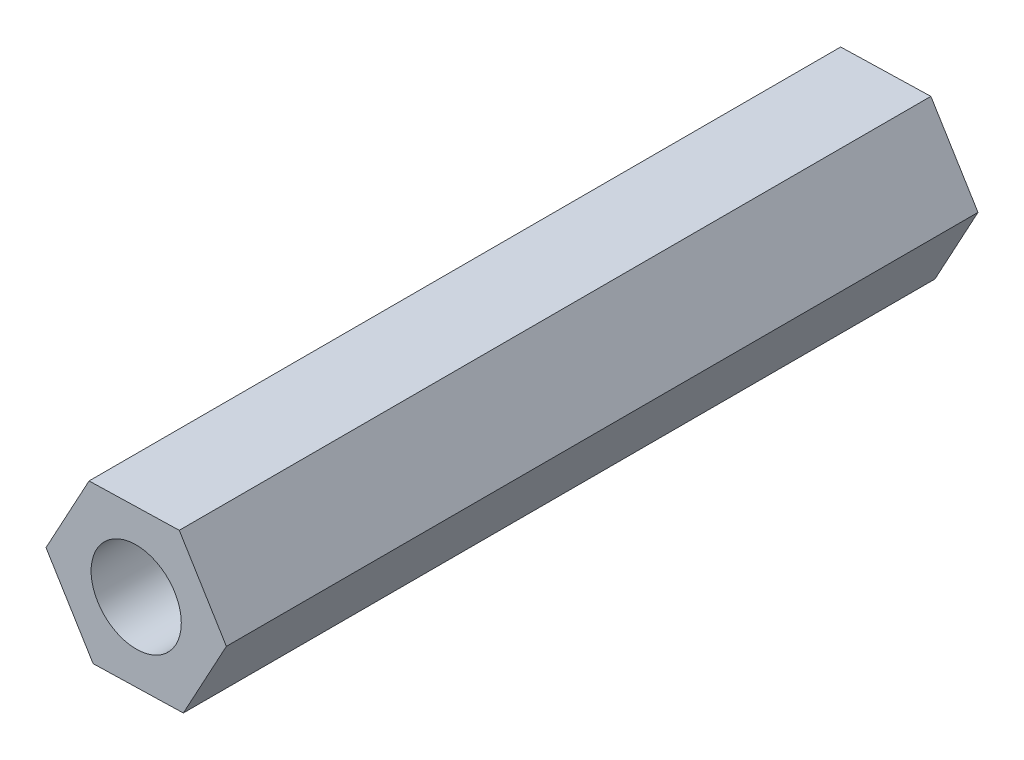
SolidWorks part; units mm, degrees
ref_plane "Plan de face" through (0, 0, 0) normal (0, 0, 1) x (1, 0, 0)
ref_plane "Plan de dessus" through (0, 0, 0) normal (0, 1, 0) x (1, 0, 0)
ref_plane "Plan de droite" through (0, 0, 0) normal (1, 0, 0) x (0, 0, -1)
ref_plane "Plan1" through (0, 0, 0) normal (0, 0, -1) x (-1, 0, 0)
sketch "Esquisse1" plane through (0, 0, 0) normal (0, 0, -1) x (-1, 0, 0)
  line L0 (1.4325, -2.6371) -> (3, -0.078)
  line L1 (3, -0.078) -> (1.5675, 2.5591)
  line L2 (1.5675, 2.5591) -> (-1.4325, 2.6371)
  line L3 (-1.4325, 2.6371) -> (-3, 0.078)
  line L4 (-3, 0.078) -> (-1.5675, -2.5591)
  line L5 (-1.5675, -2.5591) -> (1.4325, -2.6371)
  circle A0 centre (0, 0) radius 1.5
extrude "Boss.-Extru.1" add sketch "Esquisse1" against normal blind 25
